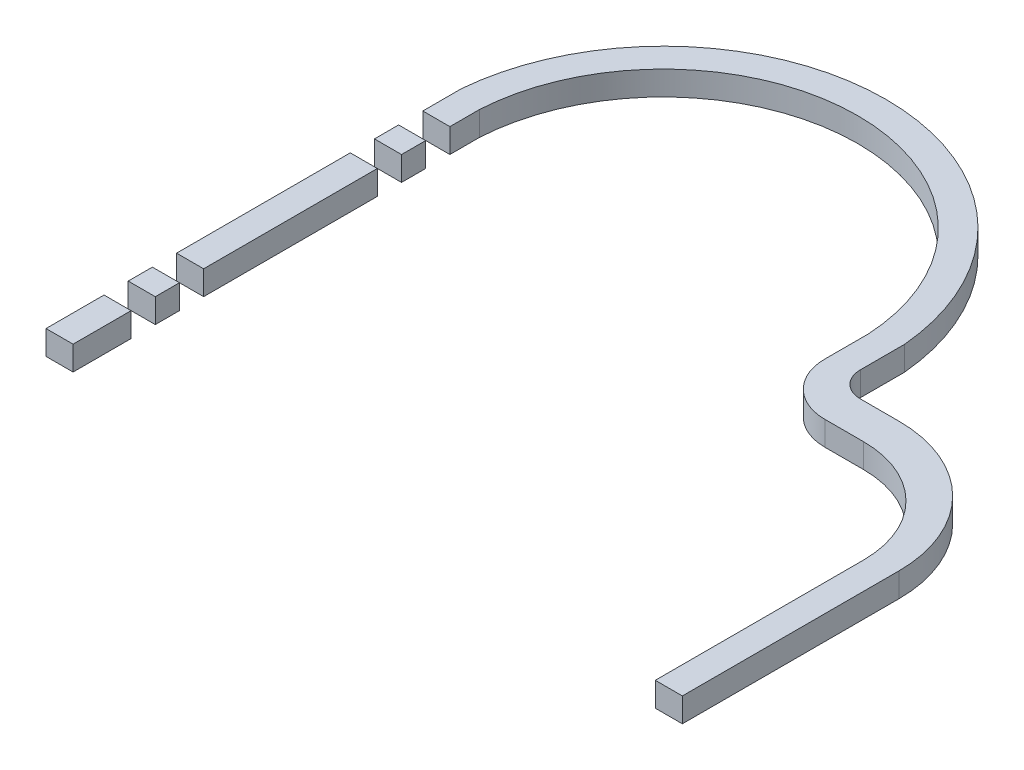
SolidWorks part; units mm, degrees
ref_plane "Front Plane" through (0, 0, 0) normal (0, 0, 1) x (1, 0, 0)
ref_plane "Top Plane" through (0, 0, 0) normal (0, 1, 0) x (1, 0, 0)
ref_plane "Right Plane" through (0, 0, 0) normal (1, 0, 0) x (0, 0, -1)
sketch "circuit outline" plane through (0, 0, 0) normal (0, 1, 0) x (1, 0, 0)
  line L0 (-69.85, 0) -> (-69.85, 15.875)
  line L1 (0, -31.75) -> (-69.85, -31.75)
  line L2 (0, -31.75) -> (0, 0)
  line L3 (0, 0) -> (-17.78, 0)
  line L4 (-69.85, -31.75) -> (-69.85, 0)
  line L5 (-25.4, 15.875) -> (-25.4, 7.62)
  arc A0 (-25.4, 15.875) -> (-69.85, 15.875) centre (-47.625, 15.875) ccw
  arc A1 (-17.78, 0) -> (-25.4, 7.62) centre (-17.78, 7.62) cw
  point P6 (-47.625, 38.1)
  dimension "D3" = 44.45
  dimension "D5" = 7.62
  dimension "D1" = 38.1
  dimension "D2" = 69.85
  dimension "D4" = 31.75
sketch "Sketch2" plane through (0, 0, 0) normal (0, 1, 0) x (1, 0, 0)
  line L0 (0, -31.75) -> (0, 0) construction
  line L1 (0, -31.75) -> (0, 0) construction
  line L2 (0, -31.75) -> (-69.85, -31.75) construction
  line L3 (-69.85, -31.75) -> (-69.85, 0) construction
  line L4 (-69.85, 0) -> (-69.85, 15.875) construction
  line L5 (-25.4, 15.875) -> (-25.4, 7.62) construction
  line L6 (0, 0) -> (-17.78, 0) construction
  line L7 (0, -31.75) -> (-69.85, -31.75) construction
  line L8 (-69.85, -31.75) -> (-69.85, 0) construction
  line L9 (-69.85, 0) -> (-69.85, 15.875) construction
  line L10 (-25.4, 15.875) -> (-25.4, 7.62) construction
  line L11 (0, 0) -> (-17.78, 0) construction
  line L12 (5.08, -36.83) -> (5.08, -10.16)
  line L13 (-10.16, 5.08) -> (-15.24, 5.08)
  line L14 (-20.32, 15.875) -> (-20.32, 10.16)
  line L15 (-74.93, 0) -> (-74.93, 15.875)
  line L16 (-74.93, -36.83) -> (-74.93, 0)
  line L17 (5.08, -36.83) -> (-74.93, -36.83)
  line L18 (-73.152, -36.1485) -> (-73.152, -38.608)
  line L19 (-76.708, -38.608) -> (6.858, -38.608)
  line L20 (-76.708, -38.608) -> (-76.708, -35.433)
  line L21 (-18.542, 15.9538) -> (-18.542, 10.16)
  line L22 (-76.708, 0) -> (-76.708, 15.9538)
  line L23 (-76.708, -38.608) -> (-76.708, 0)
  line L24 (6.858, -38.608) -> (-76.708, -38.608)
  line L25 (6.858, -38.608) -> (6.858, -10.16)
  line L26 (-10.16, 6.858) -> (-15.24, 6.858)
  line L27 (-22.098, 14.7785) -> (-22.098, 9.0635)
  line L28 (-73.152, -1.0965) -> (-73.152, 14.7785)
  line L29 (-73.152, -36.1485) -> (-73.152, -1.0965)
  line L30 (3.302, -36.1485) -> (-73.152, -36.1485)
  line L31 (3.302, -36.1485) -> (3.302, -11.2565)
  line L32 (-10.16, 2.2055) -> (-15.24, 2.2055)
  line L33 (-76.708, -35.433) -> (6.858, -35.433)
  line L34 (6.858, -38.608) -> (6.858, -35.433)
  line L35 (3.302, -36.1485) -> (3.302, -38.608)
  arc A0 (-25.4, 15.875) -> (-69.85, 15.875) centre (-47.625, 15.875) ccw construction
  arc A1 (-25.4, 7.62) -> (-17.78, 0) centre (-17.78, 7.62) ccw construction
  arc A2 (-25.4, 15.875) -> (-69.85, 15.875) centre (-47.625, 15.875) ccw construction
  arc A3 (-25.4, 7.62) -> (-17.78, 0) centre (-17.78, 7.62) ccw construction
  arc A5 (-20.32, 15.875) -> (-74.93, 15.875) centre (-47.625, 13.4126) ccw
  arc A6 (5.08, -10.16) -> (-10.16, 5.08) centre (-10.16, -10.16) ccw
  arc A8 (-15.24, 5.08) -> (-20.32, 10.16) centre (-15.24, 10.16) cw
  arc A9 (-15.24, 6.858) -> (-18.542, 10.16) centre (-15.24, 10.16) cw
  arc A10 (-18.542, 15.9538) -> (-76.708, 15.9538) centre (-47.625, 13.4126) ccw
  arc A11 (6.858, -10.16) -> (-10.16, 6.858) centre (-10.16, -10.16) ccw
  arc A12 (-15.24, 2.2055) -> (-22.098, 9.0635) centre (-15.24, 9.0635) cw
  arc A13 (-22.098, 14.7785) -> (-73.152, 14.7785) centre (-47.625, 13.335) ccw
  arc A14 (3.302, -11.2565) -> (-10.16, 2.2055) centre (-10.16, -11.2565) ccw
  dimension "D2" = 15.24
  dimension "D3" = 5.08
  dimension "D1" = 3.175
  dimension "D5" = 2.54
  dimension "D4" = 1.778
extrude "rim" add sketch "Sketch2" along normal blind 3.175 contours L25 A11 L26 A9 L21 A10 L22 L23 L24 A8 L13 A6 L12 L17 L16 L15 A5 L14 | L13 A8 L14 A5 L15 L16 L17 L12 A6 A14 L31 L30 L29 L28 A13 L27 A12 L32 | L17 L35 L24 L25 L33 L12 | L31 L35 L17 L12 L33 | L33 L20 L19 L18 L17 L16 | L33 L16 L17 L18 L29
sketch "Sketch3" plane through (-76.708, 0, 0) normal (-1, 0, 0) x (0, 0, 1)
  line L0 (38.608, 3.175) -> (-15.9538, 3.175) construction
  line L1 (-10.8738, 3.175) -> (-7.6988, 3.175)
  line L2 (-10.8738, 3.175) -> (-10.8738, 0)
  line L3 (-10.8738, 0) -> (-7.6988, 0)
  line L4 (-7.6988, 3.175) -> (-7.6988, 0)
  line L5 (38.608, 0) -> (-15.9538, 0) construction
  line L6 (-15.9538, 3.175) -> (-15.9538, 0) construction
  line L7 (38.608, 3.175) -> (38.608, 0) construction
  line L8 (-4.5238, 3.175) -> (-1.3488, 3.175)
  line L9 (-4.5238, 3.175) -> (-4.5238, 0)
  line L10 (-4.5238, 0) -> (-1.3488, 0)
  line L11 (-1.3488, 3.175) -> (-1.3488, 0)
  line L12 (21.463, 3.175) -> (24.638, 3.175)
  line L13 (21.463, 3.175) -> (21.463, 0)
  line L14 (21.463, 0) -> (24.638, 0)
  line L15 (24.638, 3.175) -> (24.638, 0)
  line L16 (27.813, 3.175) -> (30.988, 3.175)
  line L17 (27.813, 3.175) -> (27.813, 0)
  line L18 (27.813, 0) -> (30.988, 0)
  line L19 (30.988, 3.175) -> (30.988, 0)
  dimension "D1" = 5.08
  dimension "D2" = 3.175
  dimension "D3" = 3.175
  dimension "D4" = 7.62
extrude "hinge slots" cut sketch "Sketch3" against normal up to next
